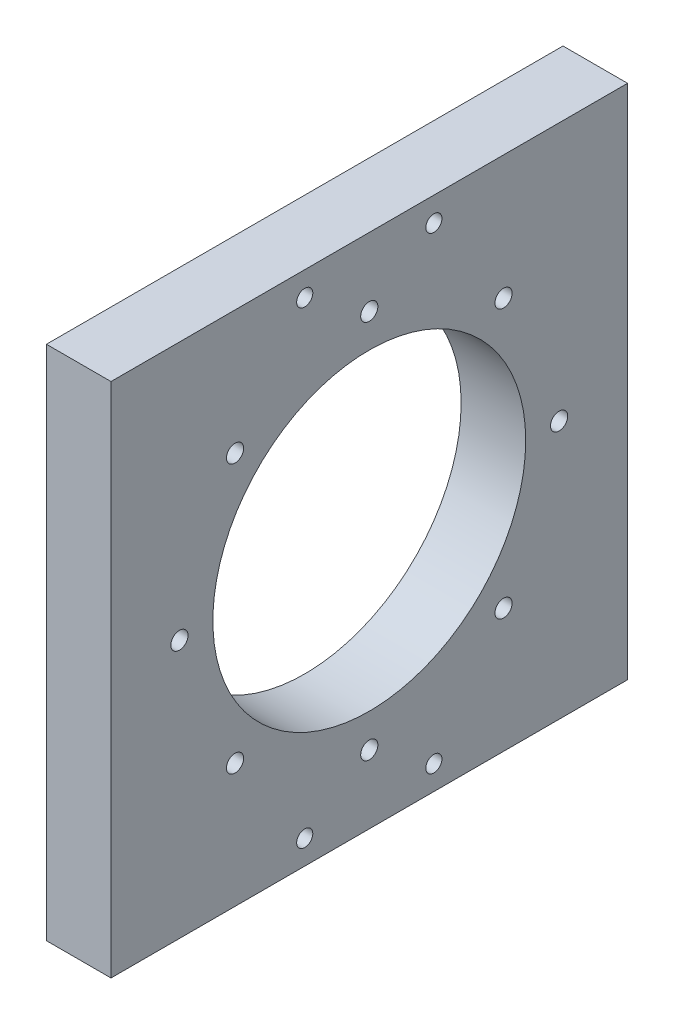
SolidWorks part; units mm, degrees
ref_plane "Front Plane" through (0, 0, 0) normal (0, 0, 1) x (1, 0, 0)
ref_plane "Top Plane" through (0, 0, 0) normal (0, 1, 0) x (1, 0, 0)
ref_plane "Right Plane" through (0, 0, 0) normal (1, 0, 0) x (0, 0, -1)
sketch "Sketch1" plane through (0, 0, 0) normal (1, 0, 0) x (0, 0, -1)
  line L1 (-101.6, -101.6) -> (101.6, -101.6)
  line L2 (-101.6, -101.6) -> (-101.6, 101.6)
  line L3 (-101.6, 101.6) -> (101.6, 101.6)
  line L4 (101.6, -101.6) -> (101.6, 101.6)
  line L7 (0, 0) -> (63.9843, 63.9843) construction
  line L9 (0, 0) -> (63.9843, -63.9843) construction
  line L11 (0, 0) -> (-63.9843, -63.9843) construction
  line L13 (0, 0) -> (-63.9843, 63.9843) construction
  circle A0 centre (0, 0) radius 61.5315
  point P17 (0, 0)
  dimension "D1" = 203.2
  dimension "D2" = 101.6
extrude "Boss-Extrude2" add sketch "Sketch1" along normal blind 25.4
sketch "Sketch2" plane through (0, 0, 0) normal (-1, 0, 0) x (0, 0, 1)
  line L0 (-0.3354, -0.4808) -> (-0.3354, 74.1952) construction
  point P9 (-0.3354, -0.4808)
sketch "Sketch5" plane through (0, 0, 0) normal (-1, 0, 0) x (0, 0, 1)
  line L0 (0, -101.6) -> (0, -92.075) construction
  line L1 (101.6, -101.6) -> (-101.6, -101.6) construction
  line L2 (0, -92.075) -> (25.4, -92.075) construction
  line L3 (0, -92.075) -> (-25.4, -92.075) construction
  dimension "D1" = 9.525
hole_wizard "1/4-20 Tapped Hole2" positions "Sketch9" profile "Sketch8" tap size "1/4-20" standard "ANSI Inch"
sketch "Sketch9" plane through (0, 0, 0) normal (-1, 0, 0) x (0, 0, 1)
  point P0 (-25.4, -92.075)
  point P3 (25.4, -92.075)
sketch "Sketch8" plane through (0, -92.075, -25.4) normal (0, 1, 0) x (0, 0, 1)
  line L0 (0, 0) -> (0, 25.4)
  line L1 (0, 25.4) -> (3.175, 25.4)
  line L2 (3.175, 25.4) -> (3.175, 0)
  line L5 (3.175, 0) -> (0, 0)
  line L11 (0, -6.35) -> (0, 107.95) construction
  dimension "Thread Major Dia." = 6.35
  dimension "Thru Tap Drill Depth" = 25.4
sketch "Sketch10" plane through (0, 0, 0) normal (-1, 0, 0) x (0, 0, 1)
  line L0 (0, 0) -> (0, 74.676) construction
hole_wizard "1/4 Clearance Hole1" positions "Sketch12" profile "Sketch13" hole size "1/4" standard "ANSI Inch"
sketch "Sketch12" plane through (0, 0, 0) normal (-1, 0, 0) x (0, 0, 1)
  point P0 (0, 74.676)
sketch "Sketch13" plane through (0, 74.676, 0) normal (0, 1, 0) x (0, 0, 1)
  line L0 (0, 0) -> (0, 25.4)
  line L1 (0, 25.4) -> (3.3782, 25.4)
  line L2 (3.3782, 25.4) -> (3.3782, 0)
  line L5 (3.3782, 0) -> (0, 0)
  line L11 (0, -6.35) -> (0, 107.95) construction
  dimension "Thru Hole Dia." = 6.7564
  dimension "Thru Hole Depth" = 25.4
pattern_circular "CirPattern1" count 8 over 360 about axis through (0, 0, 0) along (1, 0, 0) of "1/4 Clearance Hole1"
mirror "Mirror1" about plane through (0, 0, 0) normal (0, 1, 0) of "1/4-20 Tapped Hole2"
sketch "Sketch14" plane through (0, 101.6, 0) normal (0, 1, 0) x (1, 0, 0)
  line L0 (0, 0) -> (25.4, 0) construction
  line L1 (0, 101.6) -> (0, -101.6) construction
  line L2 (25.4, 101.6) -> (25.4, -101.6) construction
  line L3 (12.7, 0) -> (12.7, 17.809) construction
